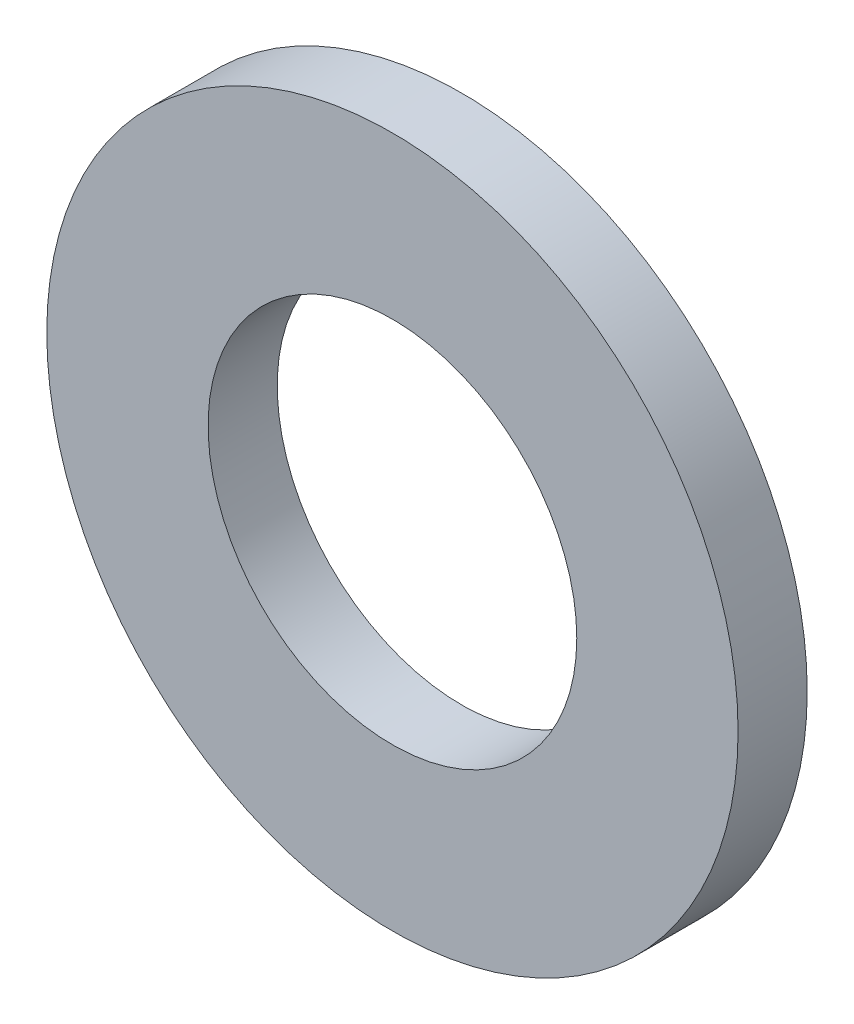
SolidWorks part; units mm, degrees
ref_plane "Plan1" through (0, 0, 0) normal (0, 0, 1) x (1, 0, 0)
ref_plane "Plan2" through (0, 0, 0) normal (0, 1, 0) x (1, 0, 0)
ref_plane "Plan3" through (0, 0, 0) normal (1, 0, 0) x (0, 0, -1)
sketch "Sketch1" plane through (0, 0, 0) normal (0, 0, 1) x (1, 0, 0)
  circle A0 centre (0, 0) radius 6
  dimension "D2" = 12
extrude "Base-Extrude" add sketch "Sketch1" along normal blind 1.2
other "Hole1"
sketch "Sketch2" plane through (0, 0, 1.2) normal (0, 0, 1) x (1, 0, 0)
  circle A0 centre (0, 0) radius 3.2
  circle A1 centre (0, 0) radius 6 construction
  dimension "D1" = 6.4
